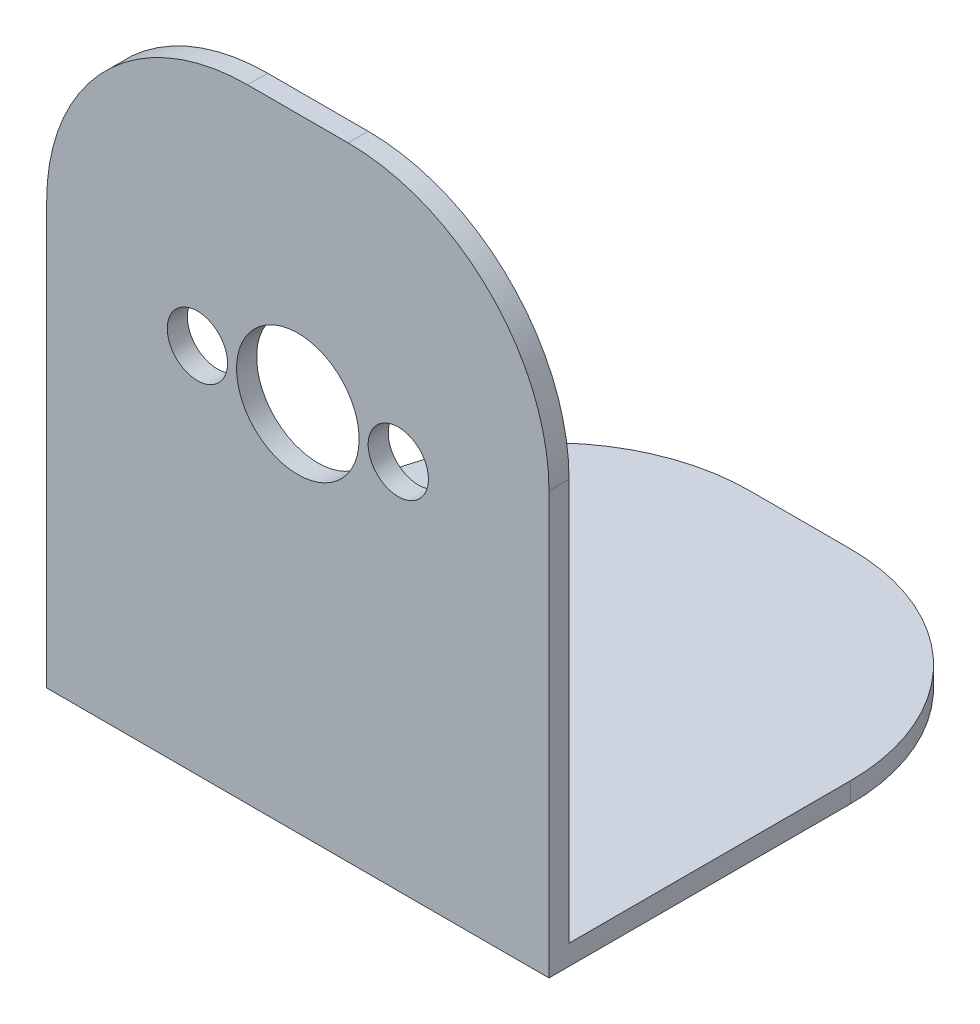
SolidWorks part; units mm, degrees
ref_plane "Front" through (0, 0, 0) normal (0, 0, 1) x (1, 0, 0)
ref_plane "Top" through (0, 0, 0) normal (0, 1, 0) x (1, 0, 0)
ref_plane "Right" through (0, 0, 0) normal (1, 0, 0) x (0, 0, -1)
sketch "Sketch1" plane through (0, 0, 0) normal (0, 0, 1) x (1, 0, 0)
  line L1 (0, 0) -> (25, 0)
  line L2 (0, 0) -> (0, 30)
  line L3 (0, 30) -> (25, 30)
  line L4 (25, 0) -> (25, 30)
  circle A1 centre (12.5, 17.5) radius 3.05
  circle A2 centre (17.5, 17.5) radius 1.5
  circle A3 centre (7.5, 17.5) radius 1.5
  dimension "D3" = 10
  dimension "D4" = 6.1
  dimension "D5" = 3
  dimension "D6" = 3
  dimension "D1" = 25
  dimension "D2" = 30
  dimension "D7" = 17.5
extrude "Extrude1" add sketch "Sketch1" along normal blind 1
sketch "Sketch2" plane through (0, 0, 0) normal (0, -1, 0) x (1, 0, 0)
  line L1 (0, 1) -> (25, 1)
  line L2 (0, 1) -> (0, -24)
  line L3 (0, -24) -> (25, -24)
  line L4 (25, 1) -> (25, -24)
  dimension "D1" = 25
  dimension "D2" = 25
extrude "Extrude2" add sketch "Sketch2" along normal blind 1
fillet "Fillet1" radius 10 4 edges at (0, -0.5, -24) (25, -0.5, -24) (0, 30, 0.5) (25, 30, 0.5)
